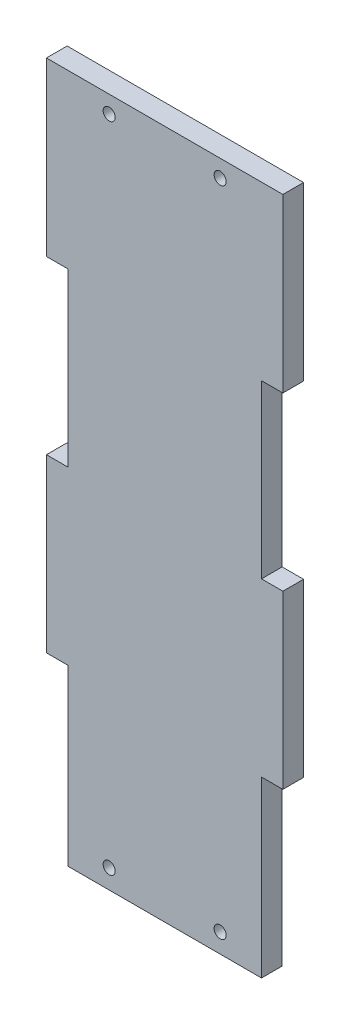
SolidWorks part; units mm, degrees
ref_plane "Alzado" through (0, 0, 0) normal (0, 0, 1) x (1, 0, 0)
ref_plane "Planta" through (0, 0, 0) normal (0, 1, 0) x (1, 0, 0)
ref_plane "Vista lateral" through (0, 0, 0) normal (1, 0, 0) x (0, 0, -1)
sketch "Croquis1" plane through (0, 0, 0) normal (0, 0, 1) x (1, 0, 0)
  line L6 (0, 0) -> (56.2, 0)
  line L10 (0, 0) -> (0, 50.5)
  line L11 (0, 200) -> (56.2, 200)
  line L12 (56.2, 0) -> (56.2, 50.5)
  line L13 (62.4, 50.5) -> (62.4, 100.3)
  line L15 (-6.2, 50.5) -> (-6.2, 100.3)
  line L16 (56.2, 100.3) -> (62.4, 100.3)
  line L17 (56.2, 200) -> (62.4, 200)
  line L19 (56.2, 150.1) -> (62.4, 150.1)
  line L20 (62.4, 200) -> (62.4, 150.1)
  line L21 (56.2, 50.5) -> (62.4, 50.5)
  line L23 (0, 200) -> (-6.2, 200)
  line L24 (-6.2, -6.2) -> (-6.2, 206.2) construction
  line L25 (-6.2, 206.2) -> (62.4, 206.2) construction
  line L26 (62.4, -6.2) -> (62.4, 206.2) construction
  line L28 (28.1, 200) -> (28.1, 154.0206) construction
  line L29 (0, 50.5) -> (-6.2, 50.5)
  line L30 (0, 100.3) -> (-6.2, 100.3)
  line L31 (0, 150.1) -> (-6.2, 150.1)
  line L33 (56.2, 100.3) -> (56.2, 150.1)
  line L34 (56.2, 0) -> (56.2, 200) construction
  line L35 (-6.2, -6.2) -> (62.4, -6.2) construction
  line L36 (-6.2, 150.1) -> (-6.2, 200)
  line L37 (0, 100.3) -> (0, 150.1)
  line L38 (0, 0) -> (0, 200) construction
  line L41 (22.1, 120) -> (34.1, 190) construction
  line L42 (22.1, 190) -> (34.1, 120) construction
  line L46 (0, 100.3) -> (12, 100.3) construction
  circle A4 centre (12, 195) radius 1.75
  circle A5 centre (44.2, 195) radius 1.75
  circle A6 centre (12, 5.6) radius 1.75
  circle A7 centre (44.2, 5.6) radius 1.75
  point P5 (28.1, 155)
  dimension "D16" = 3.5
  dimension "D1" = 200
  dimension "D2" = 56.2
  dimension "D3" = 6.2
  dimension "D4" = 49.9
  dimension "D5" = 49.8
  dimension "D6" = 49.8
  dimension "D8" = 70
  dimension "D9" = 12
  dimension "D17" = 5
  dimension "D18" = 12
extrude "Saliente-Extruir1" add sketch "Croquis1" along normal blind 6
